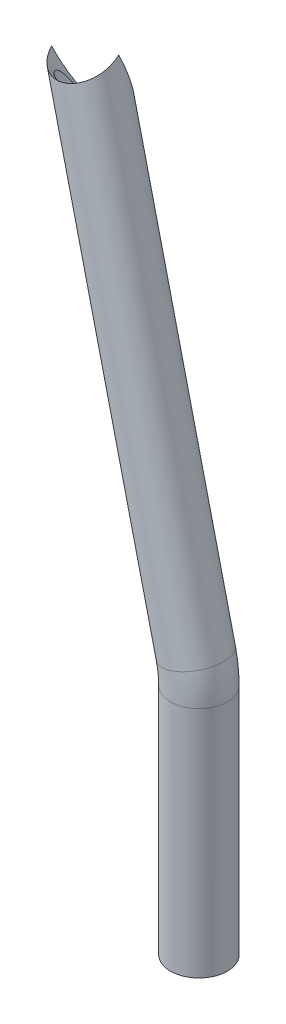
SolidWorks part; units mm, degrees
ref_plane "Plan de face" through (0, 0, 0) normal (0, 0, 1) x (1, 0, 0)
ref_plane "Plan de dessus" through (0, 0, 0) normal (0, 1, 0) x (1, 0, 0)
ref_plane "Plan de droite" through (0, 0, 0) normal (1, 0, 0) x (0, 0, -1)
sketch "Esquisse1" plane through (0, 0, 0) normal (0, 0, 1) x (1, 0, 0)
  line L0 (0, 0) -> (58.3805, -246.1538)
  line L1 (60, -260) -> (60, -382.9822)
  arc A0 (58.3805, -246.1538) -> (60, -260) centre (0, -260) cw
  point P6 (60, -252.9822)
  dimension "D4" = 60
  dimension "D1" = 260
  dimension "D2" = 130
  dimension "D3" = 60
ref_plane "Plan1" through (0, -382.9822, 0) normal (0, 1, 0) x (-1, 0, 0)
sketch "Esquisse2" plane through (0, -382.9822, 0) normal (0, 1, 0) x (-1, 0, 0)
  line L0 (0, 0) -> (-58.3805, 0) construction
  circle A0 centre (-60, 0) radius 15
  circle A1 centre (-60, 0) radius 13
  dimension "D1" = 30
  dimension "D2" = 26
sweep "Balayage1" add profiles "Esquisse2" path "Esquisse1"
sketch "Esquisse3" plane through (0, 0, 0) normal (0, 0.6944, -0.7196) x (-1, 0, 0)
  line L0 (15, -215.0342) -> (15, 407.7474) construction
  line L1 (15, 30) -> (0, 30)
  line L2 (15, 30) -> (15, -40)
  line L3 (15, -40) -> (0, -40)
  line L4 (0, 30) -> (0, -40)
  line L5 (0, -215.0342) -> (0, 407.7474) construction
  line L6 (-7.5154, 60) -> (15.0308, 60) construction
  line L7 (0, 39.9149) -> (0, -68.6906) construction
  dimension "D1" = 30
  dimension "D2" = 70
revolve "Enlèvement de matière-Révolution1" cut sketch "Esquisse3" angle 360 about L7
sketch "Esquisse4" plane through (70, 0, 0) normal (1, 0, 0) x (0, 0, -1)
  circle A0 centre (-0.3683, -417.2528) radius 16.5 construction
  circle A1 centre (-0.3683, -417.2528) radius 16.5
extrude "Enlèv. mat.-Extru.1" [suppressed] cut sketch "Esquisse4" against normal blind 45
